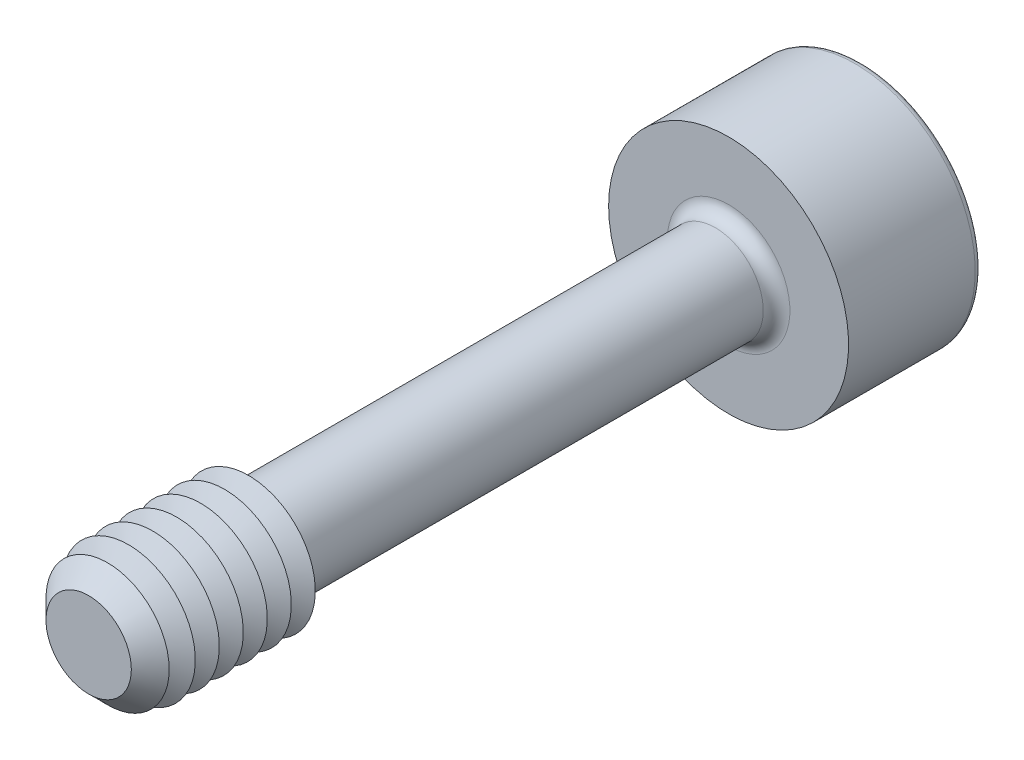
SolidWorks part; units mm, degrees
ref_plane "Front Plane" through (0, 0, 0) normal (0, 0, 1) x (1, 0, 0)
ref_plane "Top Plane" through (0, 0, 0) normal (0, 1, 0) x (1, 0, 0)
ref_plane "Right Plane" through (0, 0, 0) normal (1, 0, 0) x (0, 0, -1)
sketch "Sketch1" plane through (0, 0, 0) normal (0, 0, 1) x (1, 0, 0)
  circle A0 centre (0, 0) radius 0.9
  dimension "D1" = 1.8
extrude "Extrude1" add sketch "Sketch1" along normal mid plane 12
sketch "Sketch2" plane through (0, 0, 0) normal (1, 0, 0) x (0, 0, -1)
  line L0 (-6, 0) -> (-6, 1.25)
  line L1 (-6, 0.9) -> (-6, -0.9) construction
  line L2 (-6, 1.25) -> (-3, 1.25)
  line L3 (-3, 1.25) -> (-2.7979, 0.9)
  line L4 (6, 0.9) -> (-6, 0.9) construction
  line L5 (-2.7979, 0.9) -> (-2.7979, 0)
  line L6 (-2.7979, 0) -> (-6, 0)
  dimension "D1" = 1.25
  dimension "D2" = 120
  dimension "D3" = 3
revolve "Revolve1" add sketch "Sketch2" angle 360 about L6
chamfer "Chamfer1" distance 0.45 angle 45 1 edges at (0, 1.25, 6)
sketch "Sketch3" plane through (0, 0, -6) normal (0, 0, -1) x (-1, 0, 0)
  circle A0 centre (0, 0) radius 2.25
  dimension "D1" = 4.5
extrude "Extrude2" add sketch "Sketch3" along normal blind 2.5
sketch "Sketch4" plane through (-13.7, 0, -8.5) normal (0, 0, 1) x (1, 0, 0)
  line L2 (13.1226, -1) -> (14.2774, -1)
  line L3 (14.2774, -1) -> (14.8547, 0)
  line L4 (14.8547, 0) -> (14.2774, 1)
  line L6 (14.2774, 1) -> (13.1226, 1)
  line L7 (13.1226, 1) -> (12.5453, 0)
  line L8 (12.5453, 0) -> (13.1226, -1)
  circle A0 centre (13.7, 0) radius 1 construction
  dimension "D1" = 2
extrude "Extrude3" cut sketch "Sketch4" along normal blind 2
fillet "Fillet1" radius 0.25 1 edges at (-0.9, 0, -6)
fillet "Fillet2" radius 0.125 1 edges at (-2.25, 0, -8.5)
sketch "Sketch5" plane through (0, 0, 0) normal (1, 0, 0) x (0, 0, -1)
  line L0 (6.5, 0) -> (6.5, -1)
  line L1 (6.5, -1) -> (5.9226, 0)
  line L2 (5.9226, 0) -> (6.5, 0)
  dimension "D1" = 30
revolve "Cut-Revolve1" cut sketch "Sketch5" angle 360 about L2
sketch "Sketch6" plane through (0, 0, 0) normal (1, 0, 0) x (0, 0, -1)
  line L0 (1.332, 0) -> (-13.289, 0) construction
sketch "Sketch7" plane through (0, 0, 0) normal (1, 0, 0) x (0, 0, -1)
  line L0 (-3, 1.25) -> (-3.225, 0.8603)
  line L1 (-3.225, 0.8603) -> (-3.45, 1.25)
  line L2 (-3, 1.25) -> (-5.55, 1.25) construction
  line L3 (-3.45, 1.25) -> (-3, 1.25)
  dimension "D1" = 0.45
revolve "Cut-Revolve2" cut sketch "Sketch7" angle 360 about L0
pattern_linear "LPattern1" count 6 spacing 0.45 along (0, 0, 1) of "Cut-Revolve2"
